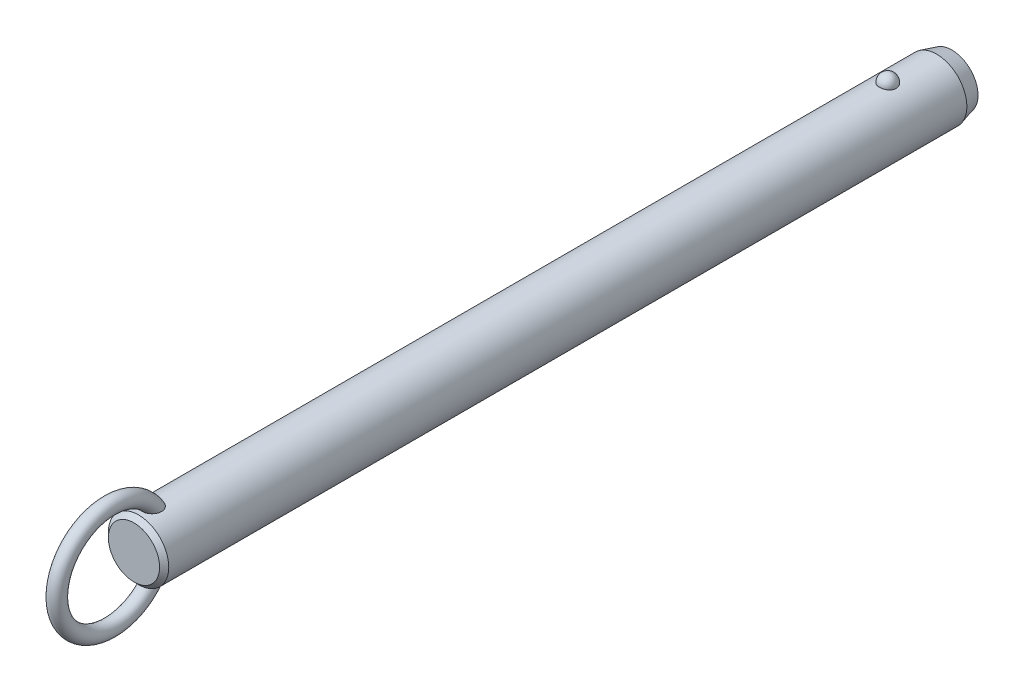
SolidWorks part; units mm, degrees
ref_plane "Front Plane" through (0, 0, 0) normal (0, 0, 1) x (1, 0, 0)
ref_plane "Top Plane" through (0, 0, 0) normal (0, 1, 0) x (1, 0, 0)
ref_plane "Right Plane" through (0, 0, 0) normal (1, 0, 0) x (0, 0, -1)
sketch "Sketch2" plane through (0, 0, 0) normal (0, 0, 1) x (1, 0, 0)
  circle A0 centre (0, 0) radius 7.9
  point P3 (0, 7.9)
  dimension "D1" = 15.8
extrude "Boss-Extrude1" add sketch "Sketch2" along normal blind 185.4
sketch "Sketch3" plane through (0, 0, 0) normal (0, 0, -1) x (-1, 0, 0)
  circle A0 centre (0, 0) radius 7.9
  dimension "D1" = 15.8
extrude "Boss-Extrude2" add sketch "Sketch3" along normal blind 19
chamfer "Chamfer1" distance 4 angle 15 1 edges at (-7.9, 0, -19)
sketch "Sketch12" plane through (0, 0, 0) normal (1, 0, 0) x (0, 0, -1)
  line L0 (-185.4, 7.9) -> (-185.4, -7.9) construction
  point P0 (-185.4, 0)
sketch "Sketch13" plane through (0, 0, 0) normal (1, 0, 0) x (0, 0, -1)
  circle A0 centre (-201.25, 0) radius 15.85
  point P2 (-185.4, 0)
  dimension "D1" = 31.7
sketch "Sketch14" plane through (0, 0, 0) normal (0, 1, 0) x (1, 0, 0)
  circle A0 centre (0, -187.4) radius 2
  point P2 (0, -185.4)
  dimension "D1" = 4
sweep "Sweep1" add profiles "Sketch14" path "Sketch13"
sketch "Sketch15" plane through (0, 0, 185.4) normal (0, 0, 1) x (1, 0, 0)
  circle A0 centre (0, 0) radius 7.9
  dimension "D1" = 15.8
extrude "Boss-Extrude3" add sketch "Sketch15" along normal blind 9.52
chamfer "Chamfer2" distance 1.2 angle 45 1 edges at (7.9, 0, 194.92)
sketch "Sketch18" plane through (0, 0, 0) normal (1, 0, 0) x (0, 0, -1)
  line L0 (15, 7.9) -> (-187.5091, 7.9) construction
  line L1 (2.2, 10.1) -> (2.2, 5.7)
  line L2 (-187.5091, -7.9) -> (15, -7.9) construction
  arc A0 (2.2, 10.1) -> (2.2, 5.7) centre (2.2, 7.9) ccw
  point P4 (0, 7.9)
  dimension "D1" = 18
revolve "Revolve1" add sketch "Sketch18" angle 360 about L1
